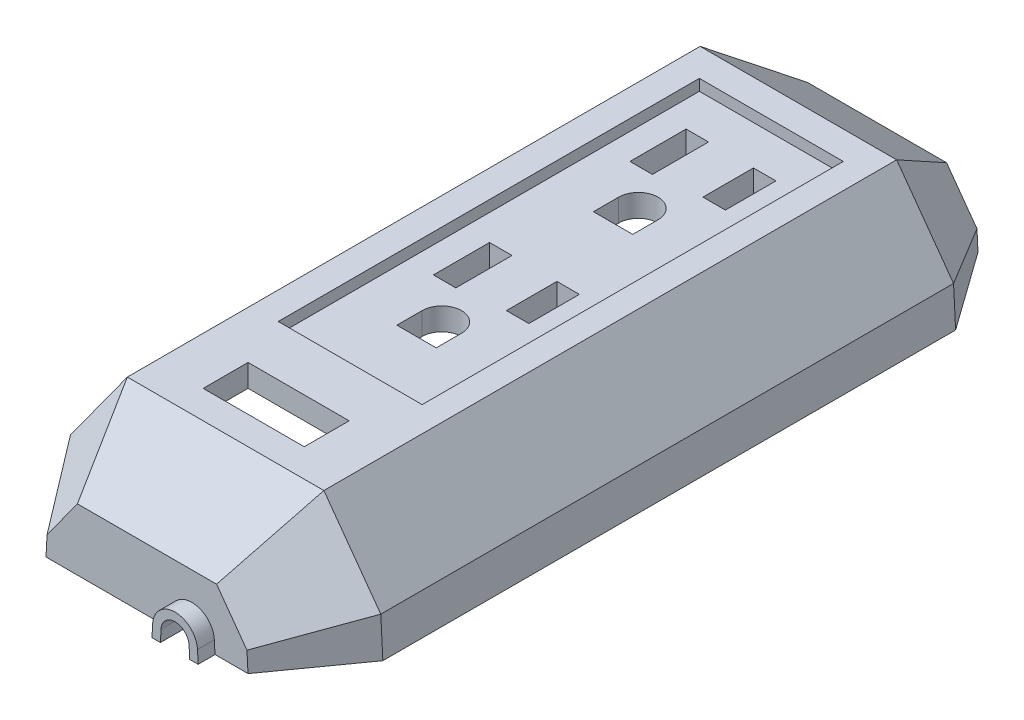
SolidWorks part; units mm, degrees
ref_plane "Front Plane" through (0, 0, 0) normal (0, 0, 1) x (1, 0, 0)
ref_plane "Top Plane" through (0, 0, 0) normal (0, 1, 0) x (1, 0, 0)
ref_plane "Right Plane" through (0, 0, 0) normal (1, 0, 0) x (0, 0, -1)
sketch "Sketch1" plane through (0, 0, 0) normal (0, 0, 1) x (1, 0, 0)
  line L0 (17.5, 21) -> (27.6331, 7)
  line L1 (-17.5, 21) -> (17.5, 21)
  line L2 (-27.6331, 7) -> (-28, 0)
  line L3 (-28, 0) -> (28, 0)
  line L4 (27.6331, 7) -> (28, 0)
  line L5 (-27.6331, 7) -> (-17.5, 21)
  line L6 (0, 0) -> (0, 21) construction
  dimension "D1" = 56
  dimension "D2" = 35
  dimension "D3" = 21
  dimension "D4" = 7
  dimension "D5" = 3
extrude "Extrude1" add sketch "Sketch1" along normal blind 130
chamfer "Chamfer1" distance 14 distance2 10 5 edges at (27.8166, 3.5, 130) (22.5666, 14, 130) (0, 21, 130) (-22.5666, 14, 130) (-27.8166, 3.5, 130)
chamfer "Chamfer2" distance 10 distance2 14 5 edges at (-27.8166, 3.5, 0) (-22.5666, 14, 0) (0, 21, 0) (22.5666, 14, 0) (27.8166, 3.5, 0)
sketch "Sketch2" plane through (5.7452, -1.8948, 130) normal (0, 0, 1) x (1, 0, 0)
  line L1 (-23.7315, 1.8948) -> (12.2411, 1.8948) construction
  line L2 (-1.8555, 1.8948) -> (6.3651, 1.8948)
  line L3 (-1.8555, 1.8948) -> (-1.7397, 4.1042)
  line L4 (6.3651, 1.8948) -> (6.2493, 4.1042)
  line L5 (2.2548, 1.8948) -> (2.2548, 3.8948) construction
  arc A0 (6.2493, 4.1042) -> (-1.7397, 4.1042) centre (2.2548, 3.8948) ccw
  circle A1 centre (2.2548, 3.8948) radius 2 construction
  dimension "D1" = 4
  dimension "D3" = 6
  dimension "D5" = 4
  dimension "D2" = 3
  dimension "D4" = 8
extrude "Extrude2" add sketch "Sketch2" along normal blind 3
ref_plane "Plane1" through (0, 30, 0) normal (0, 1, 0) x (1, 0, 0)
sketch "Sketch3" plane through (3.4925, 30, 107.5782) normal (0, 1, 0) x (1, 0, 0)
  line L0 (-31.1257, -8.4218) -> (-31.1257, 93.5782) construction
  line L1 (9.5075, 88.5782) -> (-16.1257, 88.5782)
  line L2 (9.5075, 88.5782) -> (9.5075, 13.5782)
  line L3 (9.5075, 13.5782) -> (-16.1257, 13.5782)
  line L4 (-16.1257, 88.5782) -> (-16.1257, 13.5782)
  line L6 (24.5075, -8.4218) -> (24.5075, 93.5782) construction
  line L11 (-20.9925, 93.5782) -> (-31.1257, 93.5782) construction
  dimension "D1" = 75
  dimension "D2" = 15
  dimension "D3" = 15
  dimension "D4" = 80
extrude "Cut-Extrude1" cut sketch "Sketch3" against normal offset from surface (11 mm away) 2
sketch "Sketch4" plane through (-3.0826, 30, 40.4689) normal (0, 1, 0) x (-1, 0, 0)
  line L1 (14.4174, -26.4689) -> (24.5505, -26.4689) construction
  line L3 (0.9174, -14.4689) -> (-7.0826, -14.4689) construction
  line L4 (-3.0826, 2.0311) -> (-3.0826, -14.4689) construction
  line L6 (-3.0826, 9.5311) -> (-3.0826, -90.4689) construction
  line L9 (-7.0826, -14.4689) -> (-7.0826, -5.4689)
  line L10 (-11.0826, -14.4689) -> (-7.0826, -14.4689)
  line L11 (-11.0826, -5.4689) -> (-11.0826, -14.4689)
  line L12 (-7.0826, -5.4689) -> (-11.0826, -5.4689)
  line L18 (4.9174, -14.4689) -> (4.9174, -4.4689)
  line L19 (0.9174, -14.4689) -> (4.9174, -14.4689)
  line L20 (0.9174, -4.4689) -> (0.9174, -14.4689)
  line L21 (4.9174, -4.4689) -> (0.9174, -4.4689)
  line L25 (-6.5826, 6.5311) -> (-6.5826, 2.0311)
  line L26 (0.4174, 6.5311) -> (-6.5826, 6.5311)
  line L27 (0.4174, 2.0311) -> (0.4174, 6.5311)
  arc A2 (-6.5826, 2.0311) -> (0.4174, 2.0311) centre (-3.0826, 2.0311) ccw
  dimension "D1" = 21
  dimension "D2" = 4
  dimension "D3" = 8
  dimension "D4" = 10
  dimension "D5" = 9
  dimension "D6" = 7
  dimension "D7" = 4.5
  dimension "D8" = 12
extrude "Cut-Extrude2" cut sketch "Sketch4" against normal offset from surface (15 mm away) 6
pattern_linear "LPattern1" count 2 spacing 35 along (0, 0, 1) of "Cut-Extrude2"
sketch "Sketch5" plane through (0.7926, 30, 213.5131) normal (0, 1, 0) x (1, 0, 0)
  line L0 (-0.7926, 102.5131) -> (-0.7926, 110.5131) construction
  line L1 (-9.7926, 102.5131) -> (8.2074, 102.5131)
  line L2 (-9.7926, 102.5131) -> (-9.7926, 110.5131)
  line L3 (-9.7926, 110.5131) -> (8.2074, 110.5131)
  line L4 (8.2074, 102.5131) -> (8.2074, 110.5131)
  line L5 (-28.4257, 97.5131) -> (-18.2926, 97.5131) construction
  line L8 (-0.7926, 163.5131) -> (-0.7926, 263.5131) construction
  dimension "D1" = 5
  dimension "D2" = 8
  dimension "D3" = 18
extrude "Cut-Extrude3" cut sketch "Sketch5" against normal offset from surface (13 mm away) 4
shell "Shell1" thickness 1.5
